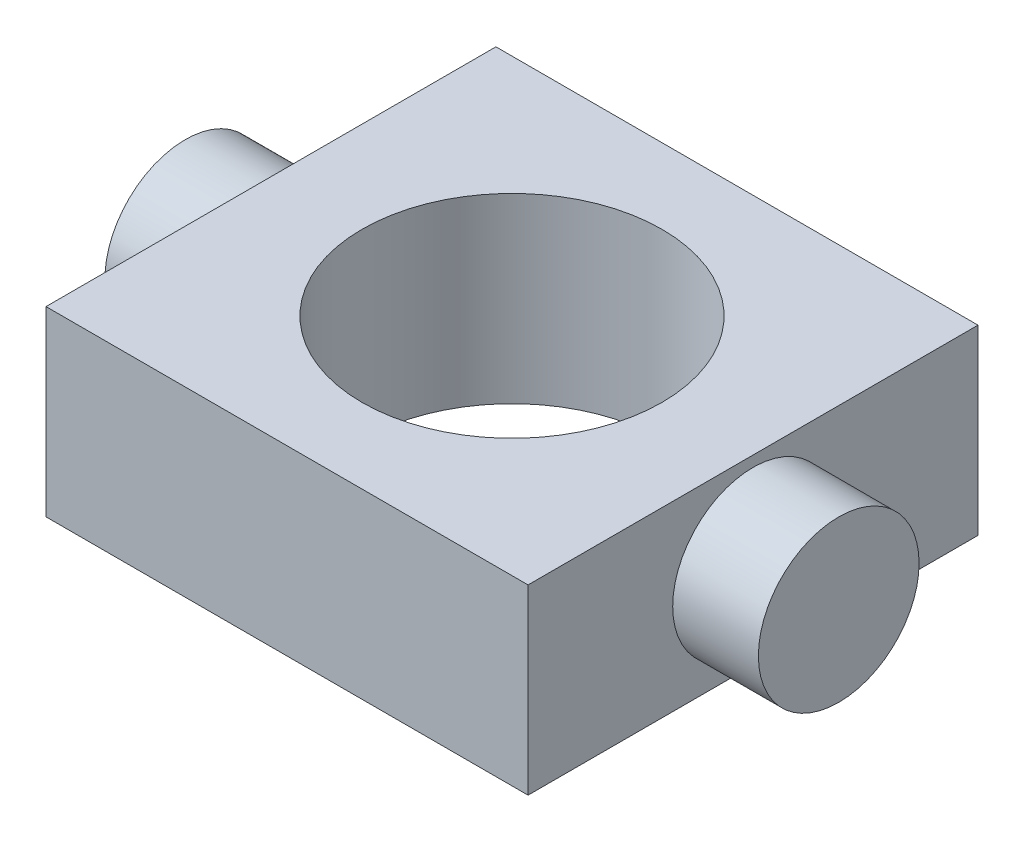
SolidWorks part; units mm, degrees
ref_plane "Face" through (0, 0, 0) normal (0, 0, 1) x (1, 0, 0)
ref_plane "Dessus" through (0, 0, 0) normal (0, 1, 0) x (1, 0, 0)
ref_plane "Droite" through (0, 0, 0) normal (1, 0, 0) x (0, 0, -1)
sketch "Esquisse1" plane through (0, 0, 0) normal (0, 0, 1) x (1, 0, 0)
  line L1 (0, 0) -> (45, 0)
  line L2 (0, 0) -> (0, 17)
  line L3 (0, 17) -> (45, 17)
  line L4 (45, 0) -> (45, 17)
  dimension "D1" = 45
  dimension "D2" = 17
extrude "Base-Extrusion" add sketch "Esquisse1" along normal blind 42
sketch "Esquisse2" plane through (0, 17, 0) normal (0, 1, 0) x (-1, 0, 0)
  line L0 (0, 0) -> (-45, 42) construction
  circle A0 centre (-22.5, 21) radius 14
  dimension "D1" = 28
extrude "Enlèv. mat.-Extru.1" cut sketch "Esquisse2" against normal through all
sketch "Esquisse3" plane through (45, 0, 0) normal (1, 0, 0) x (0, 0, -1)
  line L0 (-42, 17) -> (0, 0) construction
  circle A0 centre (-21, 8.5) radius 7.5
  dimension "D1" = 15
extrude "Boss.-Extru.1" add sketch "Esquisse3" along normal blind 8
sketch "Esquisse4" plane through (0, 17, 0) normal (0, 1, 0) x (-1, 0, 0)
  line L0 (-45, 42) -> (0, 42) construction
  point P0 (-22.5, 42)
ref_plane "Plan1" through (22.5, 0, 0) normal (1, 0, 0) x (0, 0, -1)
mirror "Symétrie1" about plane through (22.5, 0, 0) normal (1, 0, 0)
